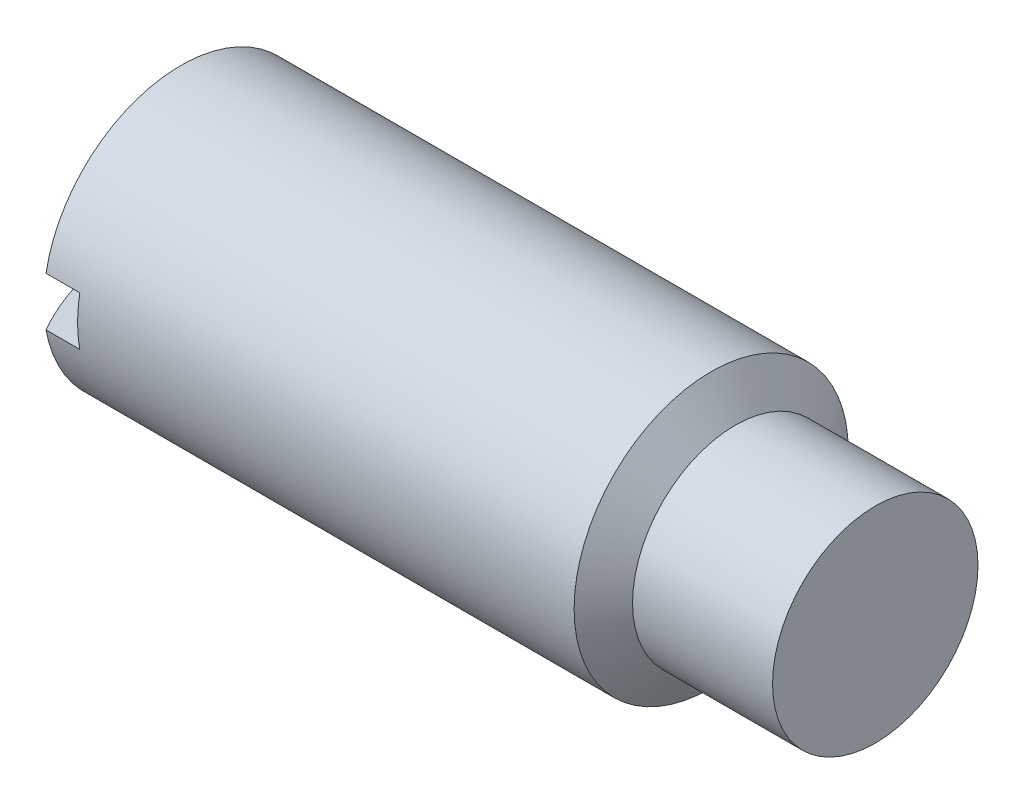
SolidWorks part; units mm, degrees
ref_plane "Plane1" through (0, 0, 0) normal (0, 0, 1) x (1, 0, 0)
ref_plane "Plane2" through (0, 0, 0) normal (0, 1, 0) x (1, 0, 0)
ref_plane "Plane3" through (0, 0, 0) normal (1, 0, 0) x (0, 0, -1)
sketch "BodySke" plane through (0, 0, 0) normal (0, 0, 1) x (1, 0, 0)
  line L0 (2.5522, -9.525) -> (19.05, -9.525) construction
  line L1 (41.0718, 7.1374) -> (50.8, 7.1374)
  line L2 (2.5522, 9.525) -> (39.4, 9.525)
  line L3 (41.0718, 7.1374) -> (39.4, 9.525)
  line L4 (50.8, 0) -> (0, 0)
  line L5 (-12.7, 0) -> (88.9, 0) construction
  line L6 (2.0066, 12.7) -> (2.0066, -6.35) construction
  line L7 (50.8, 7.1374) -> (50.8, 0)
  line L8 (41.0718, -7.1374) -> (50.8, -7.1374) construction
  arc A1 (2.5522, 9.525) -> (0, 0) centre (19.05, 0) ccw
  dimension "D1" = 125
  dimension "Crown_radius" = 19.05
  dimension "Length" = 50.8
  dimension "Diameter" = 19.05
  dimension "Dog_dia" = 14.2748
  dimension "Dog_len" = 9.7282
  dimension "Advance" = 2.0066
revolve "BaseBody" add sketch "BodySke" angle 360 about L5
sketch "Sketch2" plane through (0, 0, 0) normal (1, 0, 0) x (0, 0, -1)
  line L1 (9.525, -1.7018) -> (-9.525, -1.7018)
  line L2 (9.525, -1.7018) -> (9.525, 1.7018)
  line L3 (9.525, 1.7018) -> (-9.525, 1.7018)
  line L4 (-9.525, -1.7018) -> (-9.525, 1.7018)
  dimension "D1" = 19.05
  dimension "D2" = 1.7018
  dimension "Slot_width" = 3.4036
  dimension "D3" = 9.525
extrude "Slot" cut sketch "Sketch2" along normal blind 4.9022
sketch "ThdSchSke" plane through (0, 0, 0) normal (0, 0, 1) x (1, 0, 0)
  line L0 (2.5522, -8.0124) -> (1.4931, -9.525)
  line L1 (2.5522, -8.0124) -> (3.6113, -9.525)
  line L2 (3.6113, -9.525) -> (3.6113, -11.9063)
  line L3 (-3.175, 0) -> (5.1513, 0) construction
  line L4 (2.5522, -9.525) -> (2.5522, -1.7018) construction
  line L5 (3.6113, -11.9063) -> (1.4931, -11.9063)
  line L6 (1.4931, -11.9063) -> (1.4931, -9.525)
  dimension "Thread_minor" = 16.0249
  dimension "Diameter" = 19.05
  dimension "SideAngle" = 55
  dimension "VeeAngle" = 70
  dimension "Overcut" = 23.8125
revolve "ThreadSchematic" [suppressed] cut sketch "ThdSchSke" angle 360 about L3
pattern_linear "ThdSchPat" [suppressed]
equation "\"D1@Sketch2\" = \"Diameter@BodySke\""
equation "\"D3@Sketch2\" = \"D1@Sketch2\" / 2"
equation "\"D2@Sketch2\" = \"Slot_width@Sketch2\" / 2"
equation "\"Thread_minor@ThdSchSke\" = \"Thread_minor@ThreadCosmetic\""
equation "\"Diameter@ThdSchSke\" = \"Diameter@BodySke\""
equation "\"Overcut@ThdSchSke\" = \"Diameter@BodySke\" * 1.25"
equation "\"Num_threads@ThdSchPat\" = int ( ( \"Length@BodySke\" - ( \"Crown_radius@BodySke\" - sqr ( ( \"Crown_radius@BodySke\" * \"Crown_radius@BodySke\" ) - ( ( \"Diameter@BodySke\" * 0.5 ) * ( \"Diameter@BodySke\" * 0.5 "
equation "\"Advance@ThdSchPat\" = ( \"Length@BodySke\" - ( \"Crown_radius@BodySke\" - sqr ( ( \"Crown_radius@BodySke\" * \"Crown_radius@BodySke\" ) - ( ( \"Diameter@BodySke\" * 0.5 ) * ( \"Diameter@BodySke\" * 0.5 ) ) ) ) - "
equation "\"Num_threads@ThdSchPat\" = \"Num_threads@ThdSchPat\" - sgn( \"Num_threads@ThdSchPat\" - 1) '---chamfered tips only---"
